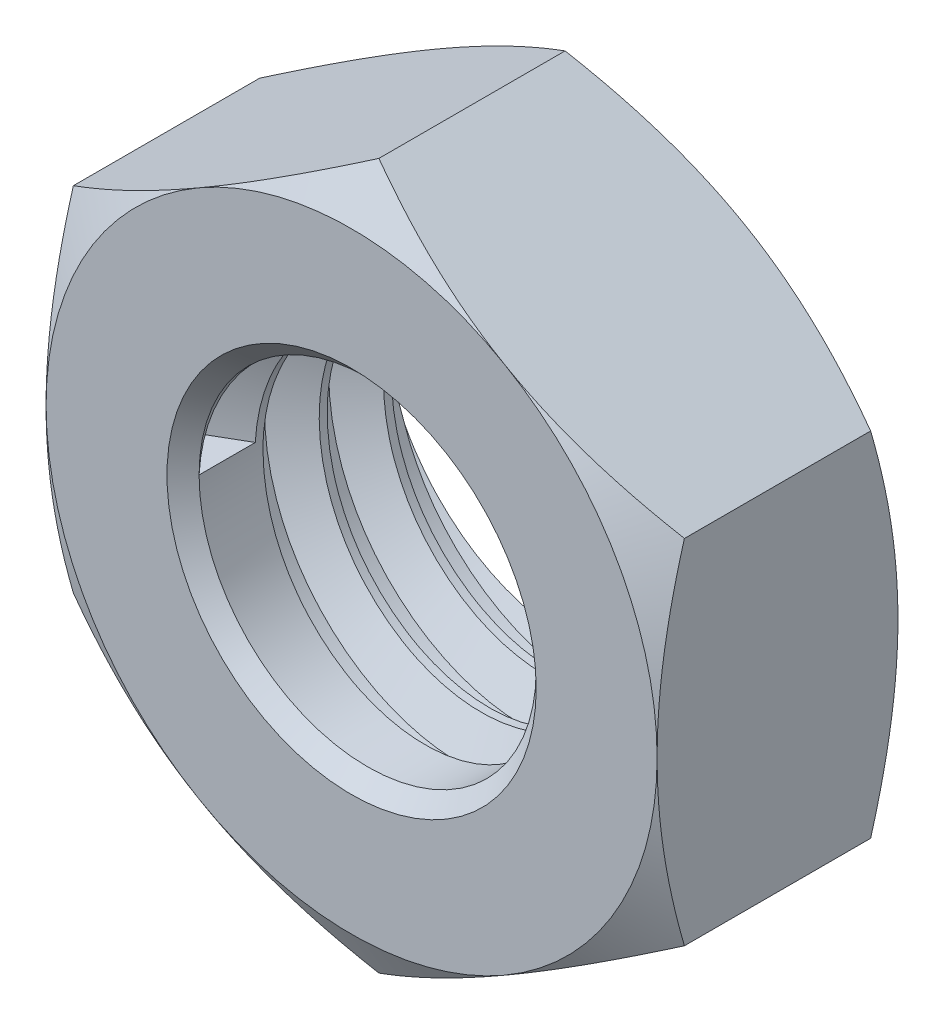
SolidWorks part; units mm, degrees
ref_plane "Front Plane" through (0, 0, 0) normal (0, 0, 1) x (1, 0, 0)
ref_plane "Top Plane" through (0, 0, 0) normal (0, 1, 0) x (1, 0, 0)
ref_plane "Right Plane" through (0, 0, 0) normal (1, 0, 0) x (0, 0, -1)
sketch "Sketch1" plane through (0, 0, 0) normal (0, 0, 1) x (1, 0, 0)
  line L1 (3.8062, -2.1975) -> (3.8062, 2.1975)
  line L2 (3.8062, 2.1975) -> (0, 4.395)
  line L3 (0, 4.395) -> (-3.8062, 2.1975)
  line L4 (-3.8062, 2.1975) -> (-3.8062, -2.1975)
  line L5 (-3.8062, -2.1975) -> (0, -4.395)
  line L6 (0, -4.395) -> (3.8062, -2.1975)
  circle A0 centre (0, 0) radius 3.8062 construction
  dimension "D1" = 8.79
extrude "Boss-Extrude1" add sketch "Sketch1" along normal blind 3
sketch "Sketch2" plane through (0, 0, 0) normal (0, 0, -1) x (-1, 0, 0)
  circle A0 centre (0, 0) radius 3.8062
extrude "Cut-Extrude1" cut sketch "Sketch2" against normal blind 3 draft 60 flip side to cut
ref_plane "Plane1" through (0, 0, 1.5) normal (0, 0, -1) x (-1, 0, 0)
mirror "Mirror1" about plane through (0, 0, 1.5) normal (0, 0, -1) of "Cut-Extrude1"
hole_wizard "M5x0.8 Tapped Hole1" positions "Sketch3" profile "Sketch4" tap size "M5x0.8" standard "ANSI Metric"
sketch "Sketch3" plane through (0, 0, 0) normal (0, 0, -1) x (-1, 0, 0)
  point P0 (0, 0)
sketch "Sketch4" plane through (0, 0, 0) normal (1, 0, 0) x (0, 1, 0)
  line L0 (0, 0) -> (0, 3)
  line L1 (0, 3) -> (2.1, 3)
  line L2 (2.1, 3) -> (2.1, 0)
  line L5 (2.1, 0) -> (0, 0)
  line L11 (0, -6.35) -> (0, 107.95) construction
  dimension "Thru Tap Drill Dia." = 4.2
  dimension "Thru Tap Drill Depth" = 3
chamfer "Chamfer1" distance 0.2 angle 45 2 edges at (-2.1, 0, 3) (-2.1, 0, 0)
ref_plane "Plane3" through (0, 0, 0.2) normal (0, 0, 1) x (1, 0, 0)
thread "Thread1" pitch 0.8 start angle 0, offset 0, length 0, pitch 0.8, diameter 4.2
ref_plane "Plane4" through (-2.1, 0, 2.8) normal (0, -1, 0) x (-1, 0, 0)
sketch "Thread Profile2" plane through (-2.1, 0, 2.8) normal (0, -1, 0) x (-1, 0, 0)
  line L0 (0, 0) -> (0, 0.8) construction
  line L11 (0, 0.7) -> (0, 0)
  line L12 (0, 0) -> (0.433, 0.25)
  line L13 (0.433, 0.25) -> (0.433, 0.45)
  line L15 (0.433, 0.45) -> (0, 0.7)
  line L17 (0.433, 0.35) -> (0, 0.35) construction
  point P3 (0, 0)
  dimension "Pitch" = 0.8
  dimension "Profile_Angle" = 60
  dimension "Profile_Land" = 0.2
  dimension "Profile_Height" = 0.433
